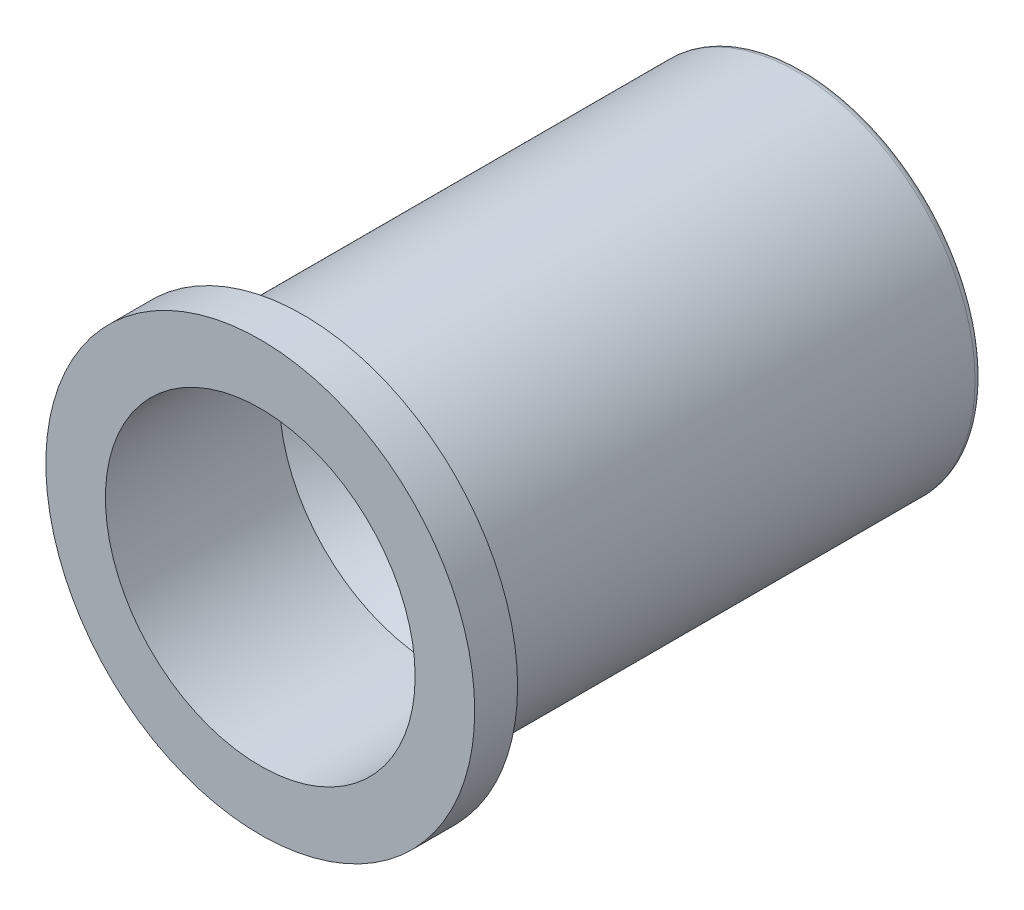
SolidWorks part; units mm, degrees
ref_plane "Front" through (0, 0, 0) normal (0, 0, 1) x (1, 0, 0)
ref_plane "Top" through (0, 0, 0) normal (0, 1, 0) x (1, 0, 0)
ref_plane "Right" through (0, 0, 0) normal (1, 0, 0) x (0, 0, -1)
other "Configuration Table"
sketch "Sketch3" plane through (0, 0, 0) normal (0, 0, 1) x (1, 0, 0)
  circle A0 centre (0, 0) radius 9
  dimension "dk" = 18
extrude "BaseHead" add sketch "Sketch3" against normal blind 1.8
sketch "Sketch4" plane through (-1.8728, 0.3563, -1.8) normal (0, 0, -1) x (-1, 0, 0)
  circle A0 centre (-1.8728, -0.3563) radius 7.5
  circle A1 centre (-1.8728, -0.3563) radius 9 construction
  dimension "d" = 15
extrude "BaseBody" add sketch "Sketch4" along normal blind 21
sketch "Sketch5" plane through (-1.3755, 3.4749, 0) normal (0, 0, 1) x (1, 0, 0)
  circle A0 centre (1.3755, -3.4749) radius 6.5
  circle A1 centre (1.3755, -3.4749) radius 9 construction
extrude "Hole1" cut sketch "Sketch5" against normal blind 7.3
sketch "Sketch6" plane through (0.0322, 0.3953, -7.3) normal (0, 0, 1) x (1, 0, 0)
  circle A0 centre (-0.0322, -0.3953) radius 5
  circle A1 centre (-0.0322, -0.3953) radius 6.5 construction
extrude "Hole2" cut sketch "Sketch6" against normal through all
fillet "Fillet1" radius 0.3 2 edges at (-7.5, 0, -22.8) (7.5, 0, -1.8)
chamfer "Chamfer1" distance 1.5 angle 45 1 edges at (5, 0, -7.3)
chamfer "Chamfer2" distance 0.5 angle 45 1 edges at (5, 0, -22.8)
sketch "Sketch7" plane through (0, 0, 0) normal (1, 0, 0) x (0, 0, -1)
  line L0 (28.4249, 0) -> (15.7466, 0) construction
  line L1 (21.8, -4) -> (22.8, -4)
  line L2 (22.8, -4) -> (22.8, -5)
  line L3 (22.8, -5) -> (22.3, -5.866)
  line L4 (22.3, -5.866) -> (21.8, -5)
  line L5 (21.8, -5) -> (21.8, -4)
  line L6 (22.3, 5) -> (22.3, -5) construction
revolve "Cut-Revolve10" [suppressed] cut sketch "Sketch7" angle 360 about L0
pattern_linear "LPattern10" [suppressed] count 12 spacing 1.2 along (0, 0, 1)
equation "\"D1@Chamfer1\" = (  \"d1@Sketch5\" - \"D1@Sketch6\" )  / 2"
equation "\"D1@Chamfer2\" = \"D1@Sketch6\" / 20"
equation "\"D1@Sketch7\" = \"D1@Sketch6\""
equation "\"D2@Sketch7\" = (  \"D2@ThreadCosmetic1\" - \"D1@Sketch6\" )  / 2"
equation "\"D3@LPattern10\" = \"D2@Sketch7\" * 1.2"
equation "\"D1@LPattern10\" =  ( \"l@BaseBody\" + \"k@BaseHead\"  - \"l1@Hole1\")  / \"D3@LPattern10\" - 1"
